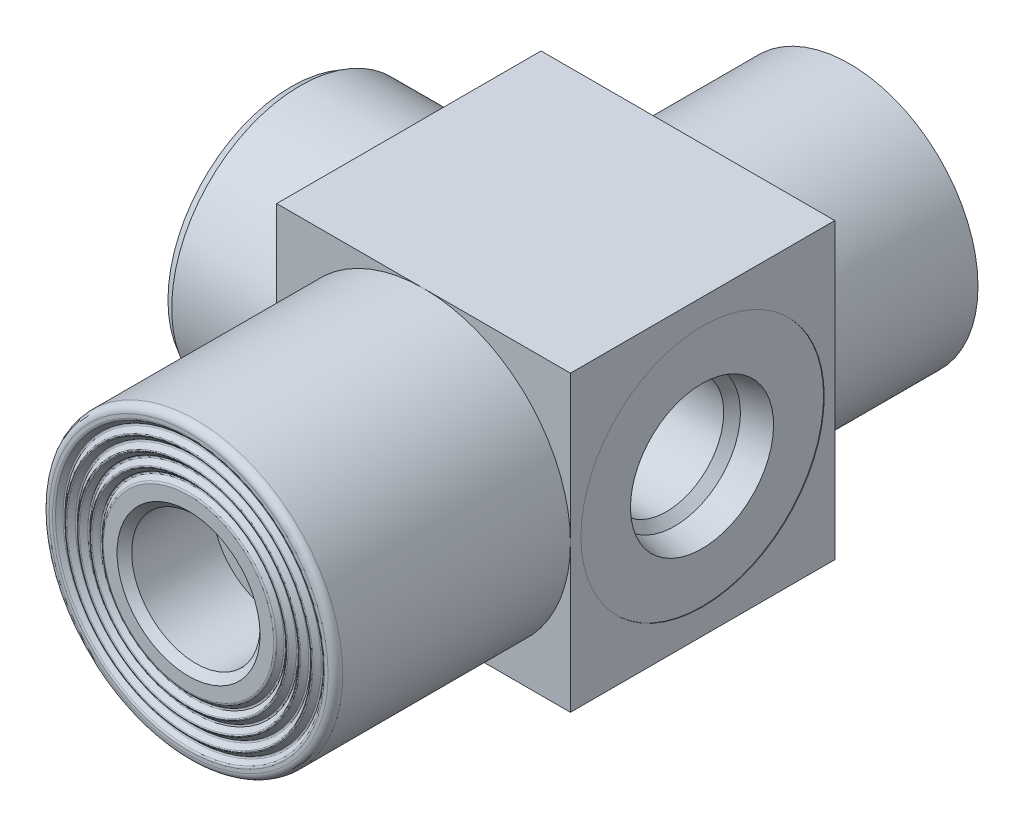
SolidWorks part; units mm, degrees
ref_plane "Plane1" through (0, 0, 0) normal (0, 0, 1) x (1, 0, 0)
ref_plane "Plane2" through (0, 0, 0) normal (0, 1, 0) x (1, 0, 0)
ref_plane "Plane3" through (0, 0, 0) normal (1, 0, 0) x (0, 0, -1)
sketch "Sketch1" plane through (0, 0, 0) normal (0, 0, 1) x (1, 0, 0)
  line L0 (0, 0) -> (0, 12.7) construction
  line L1 (-22.86, 12.7) -> (-22.86, -12.7)
  line L2 (0, 0) -> (-22.86, 0) construction
  line L3 (-22.86, 12.7) -> (12.7, 12.7)
  line L4 (12.7, -12.7) -> (12.7, 12.7)
  line L5 (-22.86, -12.7) -> (12.7, -12.7)
  dimension "D1" = 12.7
  dimension "D2" = 22.86
  dimension "D3" = 12.7
extrude "Base-Extrude" add sketch "Sketch1" along normal blind 57.15
sketch "Sketch2" plane through (0, 0, 0) normal (0, 0, -1) x (-1, 0, 0)
  circle A0 centre (0, 0) radius 11.1125
  dimension "D1" = 22.225
extrude "bladder_base1" cut sketch "Sketch2" against normal blind 13.97 flip side to cut
sketch "Sketch18" plane through (0, 0, 0) normal (0, 0, -1) x (-1, 0, 0)
  circle A0 centre (0, 0) radius 7.9375
  dimension "D1" = 15.875
extrude "oring_bore1" cut sketch "Sketch18" against normal blind 6.858
sketch "Sketch22" plane through (0, 0, 57.15) normal (0, 0, 1) x (1, 0, 0)
  circle A0 centre (0, 0) radius 12.7
  dimension "D1" = 25.4
extrude "bladder_base2" cut sketch "Sketch22" against normal blind 20.32 flip side to cut
sketch "Sketch23" plane through (-22.86, 0, 0) normal (-1, 0, 0) x (0, 0, 1)
  line L2 (13.97, -12.7) -> (13.97, 12.7) construction
  line L5 (13.97, 0) -> (36.8229, 0) construction
  line L6 (13.97, 0) -> (0, 0) construction
  circle A0 centre (25.4, 0) radius 8.6487
  dimension "D1" = 17.2974
  dimension "D2" = 11.43
extrude "ortman_bore" cut sketch "Sketch23" against normal blind 4.064
sketch "Sketch24" plane through (-22.86, 0, 0) normal (-1, 0, 0) x (0, 0, 1)
  circle A0 centre (25.4, 0) radius 7.9375
  dimension "D1" = 15.875
extrude "oring_bore" cut sketch "Sketch24" against normal blind 14.732
sketch "Sketch25" plane through (-8.128, 0, 0) normal (-1, 0, 0) x (0, 0, 1)
  circle A0 centre (25.4, 0) radius 3.175
  dimension "D1" = 6.35
extrude "thru" cut sketch "Sketch25" against normal blind 2.54
sketch "Sketch26" plane through (0, 0, 6.858) normal (0, 0, -1) x (-1, 0, 0)
  circle A0 centre (0, 0) radius 6.35
  dimension "D1" = 12.7
extrude "thread_hole1" cut sketch "Sketch26" against normal blind 8.89
sketch "Sketch32" plane through (0, 0, 57.15) normal (0, 0, 1) x (1, 0, 0)
  circle A0 centre (0, 0) radius 5.5499
  dimension "D1" = 11.0998
extrude "bladder_bore2" cut sketch "Sketch32" against normal blind 7.62
sketch "Sketch33" plane through (0, 0, 49.53) normal (0, 0, 1) x (1, 0, 0)
  circle A0 centre (0, 0) radius 3.175
  dimension "D1" = 6.35
extrude "thru_2" cut sketch "Sketch33" against normal blind 2.54
sketch "Sketch34" plane through (0, 0, 46.99) normal (0, 0, 1) x (1, 0, 0)
  circle A0 centre (0, 0) radius 4.826
  dimension "D1" = 9.652
extrude "bladder_thru" cut sketch "Sketch34" against normal blind 50.8
ref_plane "ortman_plane" through (-21.59, 0, 0) normal (-1, 0, 0) x (0, 0, 1)
sketch "Sketch36" plane through (-5.588, 0, 0) normal (-1, 0, 0) x (0, 0, 1)
  circle A0 centre (25.4, 0) radius 4.826
  dimension "D1" = 9.652
extrude "Cut-Extrude15" cut sketch "Sketch36" against normal blind 25.4
sketch "Sketch37" plane through (12.7, 0, 0) normal (1, 0, 0) x (0, 0, -1)
  circle A0 centre (-25.4, 0) radius 9.525 construction
  dimension "D1" = 19.05
sketch "Sketch38" plane through (12.7, 8.4002, 17.612) normal (1, 0, 0) x (0, 0, -1)
  circle A0 centre (-7.788, -8.4002) radius 4.9606
  dimension "D1" = 9.9212
extrude "Cut-Extrude16" cut sketch "Sketch38" against normal blind 12.7
sketch "Sketch39" plane through (12.7, 0, 25.4) normal (1, 0, 0) x (0, 0, -1)
  circle A0 centre (0, 0) radius 10.5156
  dimension "D1" = 21.0312
extrude "Cut-Extrude17" cut sketch "Sketch39" against normal blind 0.0508
sketch "Sketch40" plane through (12.6492, 0, 25.4) normal (1, 0, 0) x (0, 0, -1)
  circle A0 centre (0, 0) radius 6.1849
  dimension "D1" = 12.3698
extrude "Cut-Extrude18" cut sketch "Sketch40" against normal blind 2.3622 draft 12
sketch "Sketch41" plane through (10.287, 0, 25.4) normal (1, 0, 0) x (0, 0, -1)
  circle A0 centre (0, 0) radius 5.6828
  dimension "D1" = 11.3656
extrude "Cut-Extrude19" cut sketch "Sketch41" against normal blind 2.54 draft 45
other "LibFeat2"
chamfer "Chamfer4" distance 1.524 angle 54 1 edges at (-4.826, 0, 15.748)
sketch "Sketch42" plane through (-22.86, 0, 0) normal (-1, 0, 0) x (0, 0, 1)
  circle A0 centre (25.4, 0) radius 11.1125
  dimension "D1" = 22.225
extrude "Cut-Extrude20" cut sketch "Sketch42" against normal blind 10.16 flip side to cut
chamfer "Chamfer5" distance 0.762 angle 45 1 edges at (-6.35, 0, 6.858)
chamfer "Chamfer6" distance 0.254 angle 60 1 edges at (-22.86, 0, 34.0487)
chamfer "Chamfer7" distance 0.762 angle 30 1 edges at (-22.86, -11.1125, 25.4)
chamfer "Chamfer8" distance 0.508 angle 60 1 edges at (-7.9375, 0, 0)
chamfer "Chamfer9" distance 0.635 angle 45 1 edges at (5.5499, 0, 57.15)
chamfer "Chamfer11" distance 0.508 angle 45 1 edges at (-18.796, 0, 33.3375)
sketch "Sketch43" plane through (0, 0, 0) normal (0, 1, 0) x (1, 0, 0)
  line L0 (7.8622, -56.7554) -> (7.4676, -57.15)
  line L1 (11.6586, -57.15) -> (11.6586, -57.3469)
  line L2 (-6.1849, -57.15) -> (6.1849, -57.15) construction
  line L3 (0, -57.15) -> (0, -59.531) construction
  line L4 (11.6586, -57.3469) -> (7.4676, -57.3469)
  line L5 (9.6529, -57.1128) -> (10.0104, -56.7554)
  line L10 (8.0418, -56.7554) -> (8.3992, -57.1128)
  line L14 (8.5789, -57.1128) -> (8.9363, -56.7554)
  line L16 (7.4676, -57.3469) -> (7.4676, -57.15)
  line L18 (9.1159, -56.7554) -> (9.4733, -57.1128)
  line L23 (10.19, -56.7554) -> (10.5474, -57.1128)
  line L26 (10.727, -57.1128) -> (11.0844, -56.7554)
  line L29 (11.264, -56.7554) -> (11.6586, -57.15)
  line L30 (-12.7, -57.15) -> (12.7, -57.15) construction
  arc A0 (8.0418, -56.7554) -> (7.8622, -56.7554) centre (7.952, -56.8452) ccw
  arc A1 (8.3992, -57.1128) -> (8.5789, -57.1128) centre (8.4891, -57.023) ccw
  arc A2 (9.1159, -56.7554) -> (8.9363, -56.7554) centre (9.0261, -56.8452) ccw
  arc A3 (9.4733, -57.1128) -> (9.6529, -57.1128) centre (9.5631, -57.023) ccw
  arc A4 (10.19, -56.7554) -> (10.0104, -56.7554) centre (10.1002, -56.8452) ccw
  arc A5 (10.5474, -57.1128) -> (10.727, -57.1128) centre (10.6372, -57.023) ccw
  arc A6 (11.264, -56.7554) -> (11.0844, -56.7554) centre (11.1742, -56.8452) ccw
revolve "Cut-Revolve2" cut sketch "Sketch43" angle 360 about L3
fillet "Fillet2" radius 0.635 1 edges at (12.7, 0, 57.15)
fillet "Fillet3" radius 0.254 2 edges at (-11.6586, 0, 57.15) (-7.4676, 0, 57.15)
